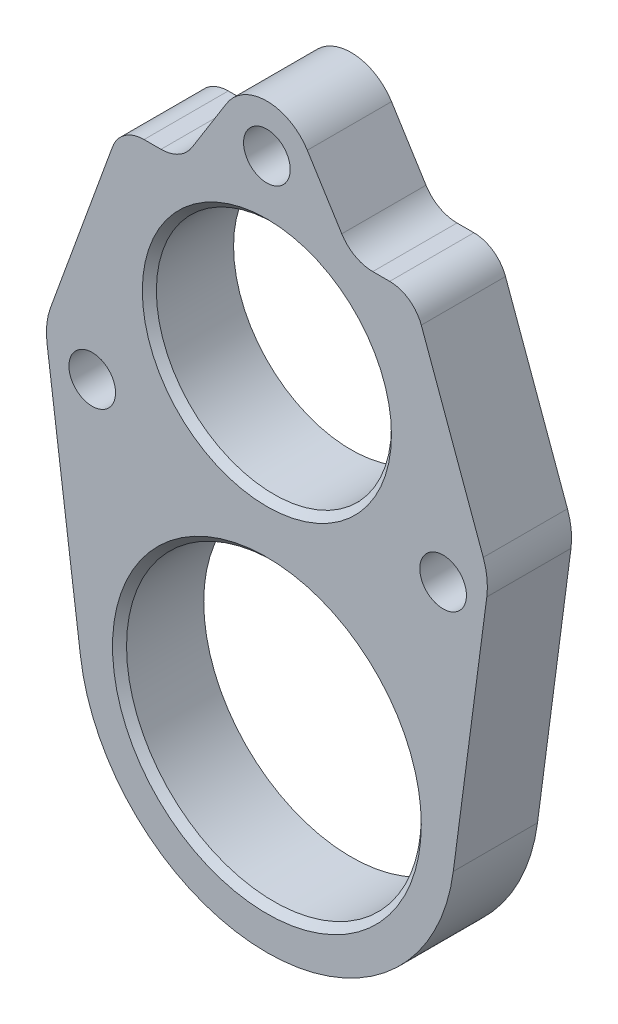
SolidWorks part; units mm, degrees
ref_plane "Plan de face" through (0, 0, 0) normal (0, 0, 1) x (1, 0, 0)
ref_plane "Plan de dessus" through (0, 0, 0) normal (0, 1, 0) x (1, 0, 0)
ref_plane "Plan de droite" through (0, 0, 0) normal (1, 0, 0) x (0, 0, -1)
sketch "Esquisse1" plane through (0, 0, 0) normal (0, 0, 1) x (1, 0, 0)
  line L3 (-22.0016, 15.6385) -> (-30.8281, -8.6122)
  line L6 (-15.0874, 18.7905) -> (-17.5, 18.7905)
  line L7 (-31.3348, -13.2387) -> (-26.5613, -49.4969)
  line L9 (-5.7587, 29.0984) -> (-10.6696, 21.2394)
  line L12 (10.6696, 21.2394) -> (5.7587, 29.0984)
  line L15 (17.5, 18.7905) -> (15.0874, 18.7905)
  line L16 (26.5613, -49.4969) -> (31.3348, -13.2387)
  line L18 (30.8281, -8.6122) -> (22.0016, 15.6385)
  arc A3 (-17.5, 18.7905) -> (-22.0016, 15.6385) centre (-17.5, 14) ccw
  arc A6 (-15.0874, 18.7905) -> (-10.6696, 21.2394) centre (-15.0874, 24) ccw
  arc A7 (-30.8281, -8.6122) -> (-31.3348, -13.2387) centre (-21.628, -11.9607) ccw
  arc A9 (5.7587, 29.0984) -> (-5.7587, 29.0984) centre (0, 25.5) ccw
  arc A12 (10.6696, 21.2394) -> (15.0874, 18.7905) centre (15.0874, 24) ccw
  arc A15 (22.0016, 15.6385) -> (17.5, 18.7905) centre (17.5, 14) ccw
  arc A16 (-26.5613, -49.4969) -> (26.5613, -49.4969) centre (0, -46) ccw
  arc A19 (31.3348, -13.2387) -> (30.8281, -8.6122) centre (21.628, -11.9607) ccw
extrude "Extrusion1" add sketch "Esquisse1" along normal blind 12
sketch "Esquisse2" plane through (0, 0, 0) normal (0, 0, -1) x (-1, 0, 0)
  line L0 (0, 32.2346) -> (0, -33.4538) construction
  circle A0 centre (0, 25.5) radius 3.3235
  circle A1 centre (-25.1116, -14.5) radius 3.3235
  circle A2 centre (24.8884, -14.5) radius 3.3235
  arc A3 (5.7587, 29.0984) -> (-5.7587, 29.0984) centre (0, 25.5) ccw construction
  point P0 (0, 25.5)
  point P1 (24.8884, -14.5)
  point P2 (-25.1116, -14.5)
  dimension "D3" = 6.647
  dimension "D1" = 50
  dimension "D2" = 40
extrude "Enlèv. mat.-Extru.1" cut sketch "Esquisse2" against normal through all
sketch "Esquisse3" plane through (0, 0, 0) normal (0, 0, -1) x (-1, 0, 0)
  circle A0 centre (0, 0) radius 16.75
  circle A1 centre (0, -46) radius 21
  dimension "D1" = 25.5
  dimension "D2" = 33.5
  dimension "D3" = 46
  dimension "D4" = 42
extrude "Enlèv. mat.-Extru.2" cut sketch "Esquisse3" against normal through all
chamfer "Chanfrein1" distance 1 angle 45 2 edges at (-21, -46, 12) (-16.75, 0, 12)
